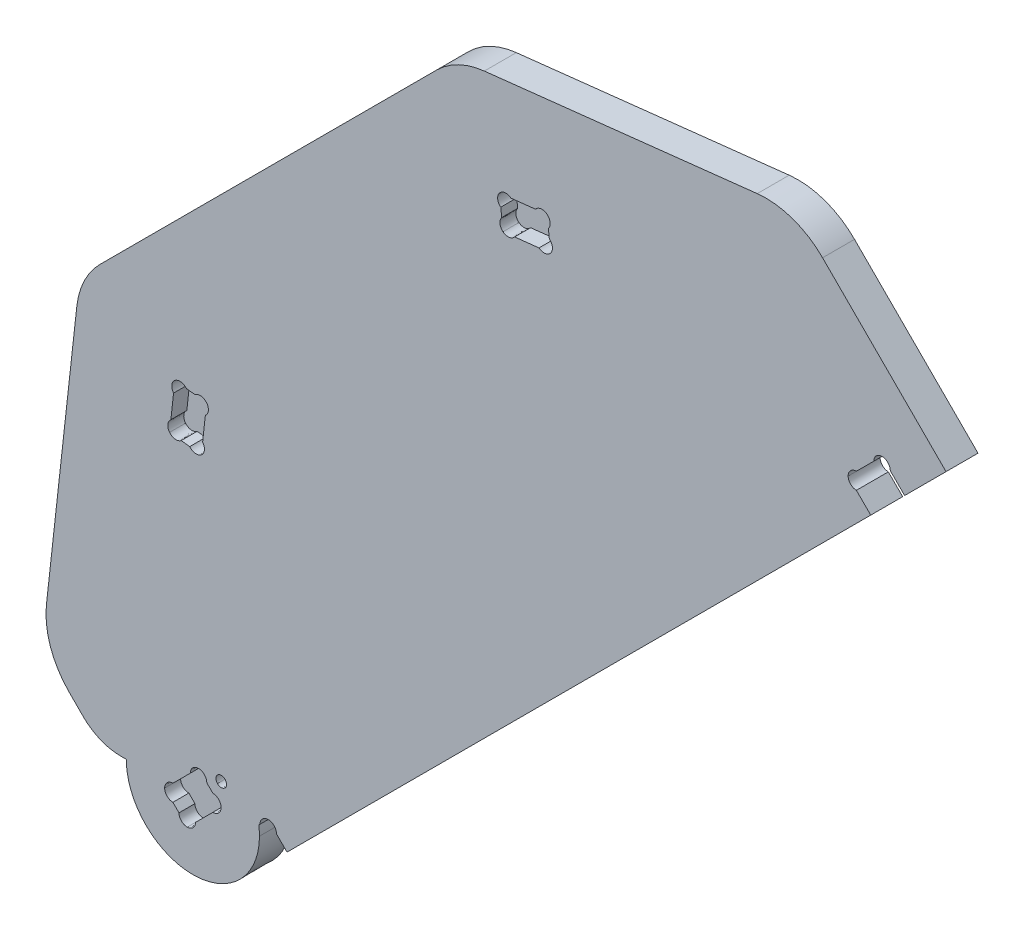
SolidWorks part; units mm, degrees
ref_plane "Plan de face" through (0, 0, 0) normal (0, 0, 1) x (1, 0, 0)
ref_plane "Plan de dessus" through (0, 0, 0) normal (0, 1, 0) x (1, 0, 0)
ref_plane "Plan de droite" through (0, 0, 0) normal (1, 0, 0) x (0, 0, -1)
body saved out of another part "Stock-Pièce3-1"
sketch "Esquisse1" plane through (0, 0, 0) normal (0, 0, -1) x (-1, 0, 0)
sketch "Esquisse2" plane through (0, 0, 0) normal (0, 0, -1) x (-1, 0, 0)
  line L13 (-2096.8563, -160.6956) -> (-2095.8208, -160.6956)
  line L14 (-2088.7497, -157.7667) -> (-2086.1699, -155.1868)
  line L15 (-2081.8682, -142.9237) -> (-2087.5621, -91.6789)
  line L16 (-2091.8637, -82.7288) -> (-2155.1332, -19.4593)
  line L17 (-2164.0834, -15.1576) -> (-2215.3282, -9.4638)
  line L18 (-2227.5912, -13.7654) -> (-2250.7777, -36.9519)
  line L19 (-2250.7777, -36.9519) -> (-2242.9995, -44.7301)
  line L20 (-2242.9995, -44.7301) -> (-2240.3069, -42.0374)
  line L21 (-2237.2069, -42.0374) -> (-2233.9429, -45.3014)
  line L22 (-2233.9429, -48.4014) -> (-2236.6356, -51.094)
  line L23 (-2236.6356, -51.094) -> (-2127.034, -160.6956)
  line L24 (-2127.034, -160.6956) -> (-2125.0485, -158.7101)
  line L25 (-2121.9485, -158.7101) -> (-2121.7307, -158.9278)
  line L26 (-2096.8563, -160.6956) -> (-2095.8208, -160.6956)
  line L27 (-2088.7497, -157.7667) -> (-2086.1699, -155.1868)
  line L28 (-2081.8682, -142.9237) -> (-2087.5621, -91.6789)
  line L29 (-2091.8637, -82.7288) -> (-2155.1332, -19.4593)
  line L30 (-2164.0834, -15.1576) -> (-2215.3282, -9.4638)
  line L31 (-2227.5912, -13.7654) -> (-2250.7777, -36.9519)
  line L32 (-2250.7777, -36.9519) -> (-2242.9995, -44.7301)
  line L33 (-2242.9995, -44.7301) -> (-2240.3069, -42.0374)
  line L34 (-2237.2069, -42.0374) -> (-2233.9429, -45.3014)
  line L35 (-2233.9429, -48.4014) -> (-2236.6356, -51.094)
  line L36 (-2236.6356, -51.094) -> (-2127.034, -160.6956)
  line L37 (-2127.034, -160.6956) -> (-2125.0485, -158.7101)
  line L38 (-2121.9485, -158.7101) -> (-2121.7307, -158.9278)
  arc A1 (-2121.7307, -158.9278) -> (-2121.8563, -160.6956) centre (-2109.3563, -160.6956) ccw
  arc A2 (-2121.7307, -158.9278) -> (-2121.8563, -160.6956) centre (-2109.3563, -160.6956) ccw
  spline S13 degree 3 poles (-742.1579, 2479.8381) (-4032.0696, -2531.4127) (261.337, 1761.9824) (-4749.7902, -1527.8284) knots 18.604709 18.604709 18.604709 18.604709 34.395186 34.395186 34.395186 34.395186 only from (-2109.3563, -173.1956) to (-2096.8563, -160.6956)
  spline S14 degree 3 poles (202.699, 1744.2788) (-4775.0492, -1589.2019) (815.8692, 726.6352) (-5061.1088, -436.0532) knots -15.511298 -15.511298 -15.511298 -15.511298 18.511375 18.511375 18.511375 18.511375 only from (-2095.8208, -160.6956) to (-2088.7497, -157.7667)
  spline S15 degree 3 poles (-2102.0547, 2825.3711) (-2770.7804, -3121.4364) (-763.4583, 2600.9968) (-3956.2057, -2460.4152) knots -9.514735 -9.514735 -9.514735 -9.514735 16.514718 16.514718 16.514718 16.514718 only from (-2086.1699, -155.1868) to (-2081.8682, -142.9237)
  spline S16 degree 3 poles (-4211.9198, 1998.3207) (-472.3948, -2672.9618) (-3098.5298, 2791.0323) (-1786.9142, -3047.2294) knots -11.781901 -11.781901 -11.781901 -11.781901 22.781987 22.781987 22.781987 22.781987 only from (-2087.5621, -91.6789) to (-2091.8637, -82.7288)
  spline S17 degree 3 poles (-5119.5904, 285.4804) (718.6152, -1026.1156) (-4745.3818, 1600.0134) (-74.0489, -2139.5433) knots -9.781901 -9.781901 -9.781901 -9.781901 24.781987 24.781987 24.781987 24.781987 only from (-2155.1332, -19.4593) to (-2164.0834, -15.1576)
  spline S18 degree 3 poles (-4532.8297, -1883.8075) (528.5965, 1308.9467) (-5193.8373, -698.3738) (752.9549, -29.6516) knots -3.514735 -3.514735 -3.514735 -3.514735 22.514718 22.514718 22.514718 22.514718 only from (-2215.3282, -9.4638) to (-2227.5912, -13.7654)
  spline S19 degree 3 poles (176.2028, 1729.5216) (-4476.2854, -2062.1771) (-218.6214, 2195.4877) (-4010.306, -2456.9849) knots -2.355184 -2.355184 -2.355184 -2.355184 29.355157 29.355157 29.355157 29.355157 only from (-2240.3069, -42.0374) to (-2238.7569, -40.4874)
  spline S20 degree 3 poles (-467.1978, -2456.9971) (-4258.8965, 2195.491) (-1.2318, -2062.1729) (-4653.7044, 1729.5117) knots -1.355184 -1.355184 -1.355184 -1.355184 30.355157 30.355157 30.355157 30.355157 only from (-2238.7569, -40.4874) to (-2237.2069, -42.0374)
  spline S21 degree 3 poles (-462.3839, -2461.8111) (-4254.0826, 2190.6771) (3.5822, -2066.9869) (-4648.8904, 1724.6977) knots 0.644816 0.644816 0.644816 0.644816 32.355157 32.355157 32.355157 32.355157 only from (-2233.9429, -45.3014) to (-2232.3929, -46.8514)
  spline S22 degree 3 poles (-4648.9026, -1818.4104) (3.5855, 1973.2882) (-4254.0784, -2284.3765) (-462.3938, 2368.0961) knots 1.644816 1.644816 1.644816 1.644816 33.355157 33.355157 33.355157 33.355157 only from (-2232.3929, -46.8514) to (-2233.9429, -48.4014)
  spline S23 degree 3 poles (291.4612, 1612.849) (-4361.027, -2178.8497) (-103.363, 2078.815) (-3895.0476, -2573.6575) knots 5.644816 5.644816 5.644816 5.644816 37.355157 37.355157 37.355157 37.355157 only from (-2125.0485, -158.7101) to (-2123.4985, -157.1601)
  spline S24 degree 3 poles (-351.9394, -2573.6698) (-4143.6381, 2078.8184) (114.0266, -2178.8456) (-4538.446, 1612.839) knots 6.644816 6.644816 6.644816 6.644816 38.355157 38.355157 38.355157 38.355157 only from (-2123.4985, -157.1601) to (-2121.9485, -158.7101)
  spline S25 degree 3 poles (531.1774, -1527.894) (-4480.0734, 1762.0176) (-186.6783, -2531.3889) (-3476.4892, 2479.7382) knots 17.604709 17.604709 17.604709 17.604709 33.395186 33.395186 33.395186 33.395186 only from (-2121.8563, -160.6956) to (-2109.3563, -173.1956)
  spline S26 degree 3 poles (-2109.3563, -173.1956) (-2102.4528, -173.1956) (-2096.8563, -167.5992) (-2096.8563, -160.6956) knots 26 26 26 26 27 27 27 27
  spline S27 degree 3 poles (-2095.8208, -160.6956) (-2093.1686, -160.6956) (-2090.6251, -159.642) (-2088.7497, -157.7667) knots 1 1 1 1 2 2 2 2
  spline S28 degree 3 poles (-2086.1699, -155.1868) (-2082.9478, -151.9647) (-2081.365, -147.4526) (-2081.8682, -142.9237) knots 3 3 3 3 4 4 4 4
  spline S29 degree 3 poles (-2087.5621, -91.6789) (-2087.9382, -88.2937) (-2089.4553, -85.1372) (-2091.8637, -82.7288) knots 5 5 5 5 6 6 6 6
  spline S30 degree 3 poles (-2155.1332, -19.4593) (-2157.5417, -17.0508) (-2160.6981, -15.5338) (-2164.0834, -15.1576) knots 7 7 7 7 8 8 8 8
  spline S31 degree 3 poles (-2215.3282, -9.4638) (-2219.857, -8.9606) (-2224.3691, -10.5433) (-2227.5912, -13.7654) knots 9 9 9 9 10 10 10 10
  spline S32 degree 3 poles (-2240.3069, -42.0374) (-2240.3069, -41.1814) (-2239.6129, -40.4874) (-2238.7569, -40.4874) knots 13 13 13 13 14 14 14 14
  spline S33 degree 3 poles (-2238.7569, -40.4874) (-2237.9008, -40.4874) (-2237.2069, -41.1814) (-2237.2069, -42.0374) knots 14 14 14 14 15 15 15 15
  spline S34 degree 3 poles (-2233.9429, -45.3014) (-2233.0869, -45.3014) (-2232.3929, -45.9954) (-2232.3929, -46.8514) knots 16 16 16 16 17 17 17 17
  spline S35 degree 3 poles (-2232.3929, -46.8514) (-2232.3929, -47.7074) (-2233.0869, -48.4014) (-2233.9429, -48.4014) knots 17 17 17 17 18 18 18 18
  spline S36 degree 3 poles (-2125.0485, -158.7101) (-2125.0485, -157.854) (-2124.3545, -157.1601) (-2123.4985, -157.1601) knots 21 21 21 21 22 22 22 22
  spline S37 degree 3 poles (-2123.4985, -157.1601) (-2122.6424, -157.1601) (-2121.9485, -157.854) (-2121.9485, -158.7101) knots 22 22 22 22 23 23 23 23
  spline S38 degree 3 poles (-2121.8563, -160.6956) (-2121.8563, -167.5992) (-2116.2599, -173.1956) (-2109.3563, -173.1956) knots 25 25 25 25 26 26 26 26
  dimension "D1" = 0
extrude "Boss.-Extru.1" add sketch "Esquisse2" against normal blind 3 contours A2 S38 S26 L26 S27 L27 S28 L28 S29 L29 S30 L30 S31 L31 L32 L33 S32 S33 L34 S34 S35 L35 L36 L37 S36 S37 L38
